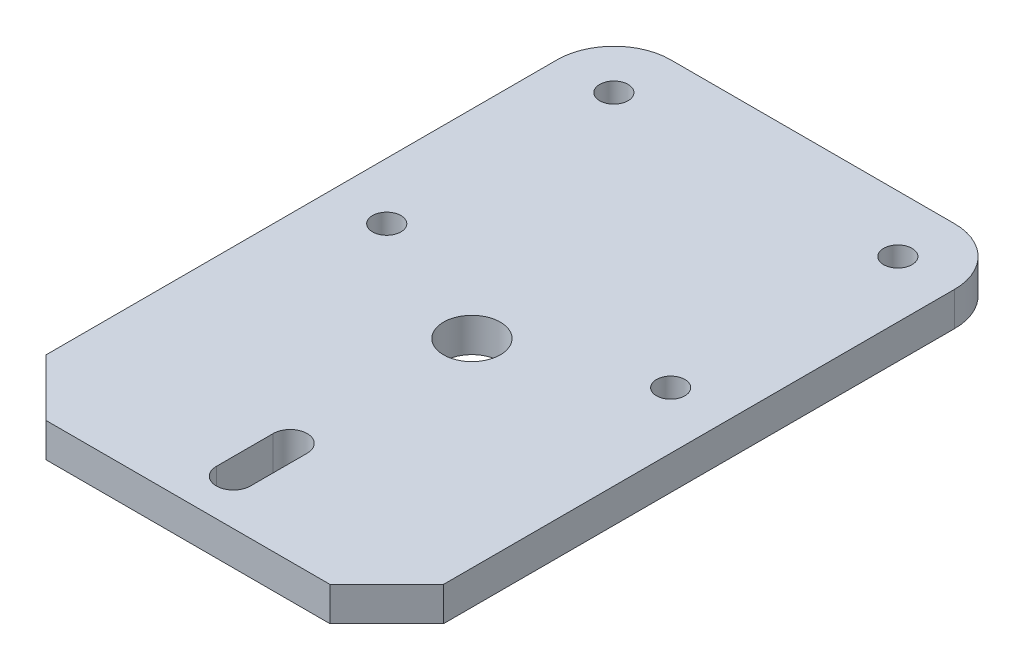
SolidWorks part; units mm, degrees
ref_plane "Front" through (0, 0, 0) normal (0, 0, 1) x (1, 0, 0)
ref_plane "Top" through (0, 0, 0) normal (0, 1, 0) x (1, 0, 0)
ref_plane "Right" through (0, 0, 0) normal (1, 0, 0) x (0, 0, -1)
sketch "Sketch1" plane through (0, 0, 0) normal (0, 1, 0) x (1, 0, 0)
  line L0 (32, 18) -> (32, 8)
  line L1 (10, 0) -> (60, 0)
  line L2 (0, 10) -> (0, 100)
  line L3 (10, 110) -> (60, 110)
  line L4 (70, 10) -> (70, 100)
  line L7 (38, 18) -> (38, 8)
  line L8 (0, 10) -> (10, 0)
  line L9 (60, 0) -> (70, 10)
  circle A0 centre (10, 100) radius 2.5
  circle A1 centre (60, 100) radius 2.5
  circle A2 centre (10, 60) radius 2.5
  circle A3 centre (60, 60) radius 2.5
  circle A4 centre (35, 50) radius 5
  arc A5 (38, 18) -> (32, 18) centre (35, 18) ccw
  arc A6 (32, 8) -> (38, 8) centre (35, 8) ccw
  arc A7 (0, 100) -> (10, 110) centre (10, 100) cw
  arc A8 (70, 100) -> (60, 110) centre (60, 100) ccw
extrude "Extrude1" add sketch "Sketch1" along normal blind 6
